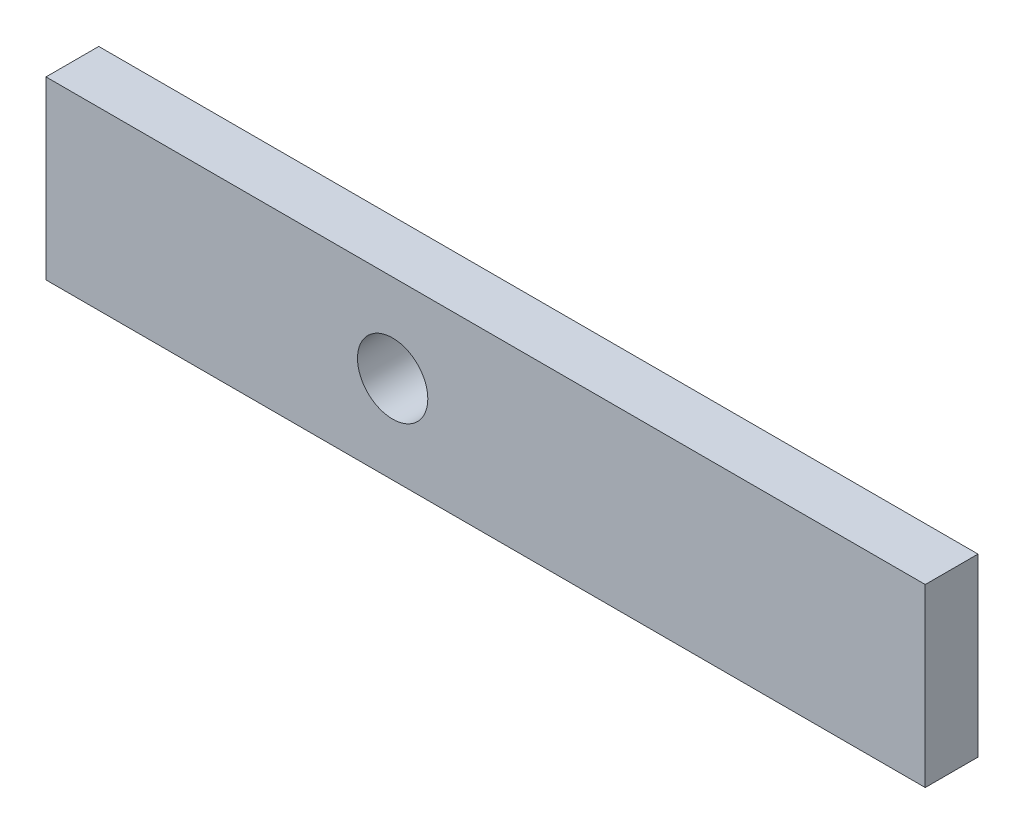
SolidWorks part; units mm, degrees
ref_plane "Plan1" through (0, 0, 0) normal (0, 0, 1) x (1, 0, 0)
ref_plane "Plan2" through (0, 0, 0) normal (0, 1, 0) x (1, 0, 0)
ref_plane "Plan3" through (0, 0, 0) normal (1, 0, 0) x (0, 0, -1)
sketch "Esquisse1" plane through (0, 0, 0) normal (0, 0, 1) x (1, 0, 0)
  line L1 (0, 0) -> (100, 0)
  line L2 (0, 0) -> (0, 20)
  line L3 (0, 20) -> (100, 20)
  line L4 (100, 0) -> (100, 20)
  dimension "D1" = 20
  dimension "D2" = 100
extrude "Base-Extrusion" add sketch "Esquisse1" along normal blind 6
sketch "Esquisse2" plane through (0, 0, 6) normal (0, 0, 1) x (1, 0, 0)
  line L0 (100, 20) -> (0, 20) construction
  line L1 (100, 0) -> (100, 20) construction
  circle A0 centre (39.4263, 10) radius 4
  point P4 (100, 10)
  dimension "D1" = 8
  dimension "D2" = 10
  dimension "D3" = 60.5737
extrude "Enlèv. mat.-Extru.1" cut sketch "Esquisse2" against normal through all
